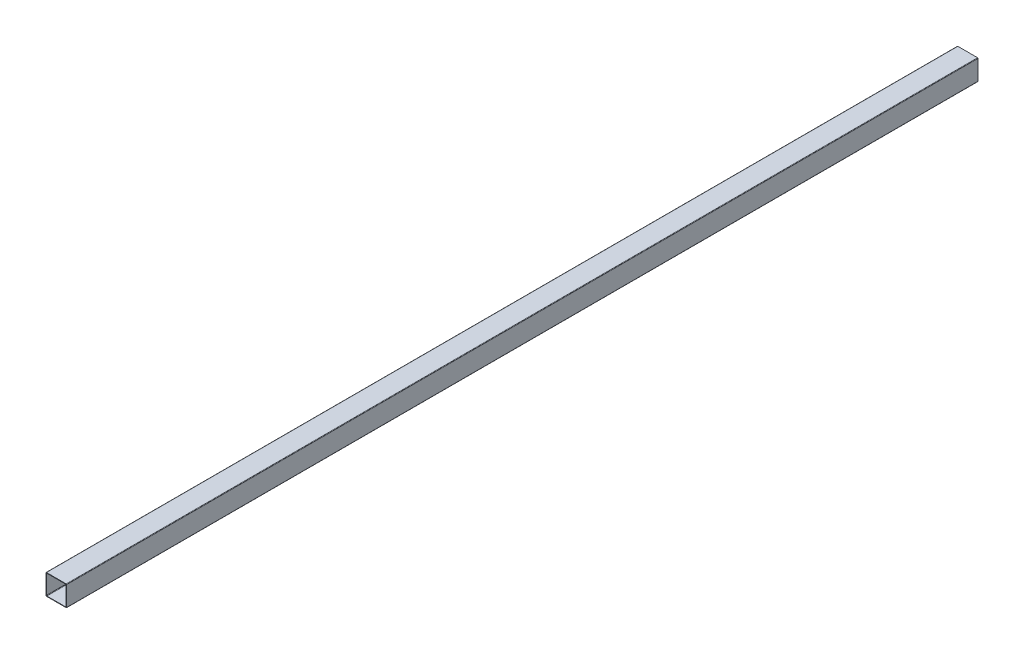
SolidWorks part; units mm, degrees
ref_plane "Plan de face" through (0, 0, 0) normal (0, 0, 1) x (1, 0, 0)
ref_plane "Plan de dessus" through (0, 0, 0) normal (0, 1, 0) x (1, 0, 0)
ref_plane "Plan de droite" through (0, 0, 0) normal (1, 0, 0) x (0, 0, -1)
sketch "Esquisse1" plane through (0, 0, 0) normal (0, 0, 1) x (1, 0, 0)
  line L1 (41, -43) -> (-41, -43)
  line L2 (43, -41) -> (43, 41)
  line L3 (41, 43) -> (-41, 43)
  line L4 (-43, -41) -> (-43, 41)
  line L5 (43, -43) -> (-43, 43) construction
  line L6 (43, 43) -> (-43, -43) construction
  line L7 (43, -45) -> (-43, -45)
  line L8 (45, -43) -> (45, 43)
  line L9 (43, 45) -> (-43, 45)
  line L10 (-45, -43) -> (-45, 43)
  line L11 (45, -45) -> (-45, 45) construction
  line L12 (45, 45) -> (-45, -45) construction
  arc A0 (-41, 43) -> (-43, 41) centre (-41, 41) ccw
  arc A1 (43, 41) -> (41, 43) centre (41, 41) ccw
  arc A2 (41, -43) -> (43, -41) centre (41, -41) ccw
  arc A3 (-41, -43) -> (-43, -41) centre (-41, -41) cw
  arc A4 (-43, -45) -> (-45, -43) centre (-43, -43) cw
  arc A5 (43, -45) -> (45, -43) centre (43, -43) ccw
  arc A6 (45, 43) -> (43, 45) centre (43, 43) ccw
  arc A7 (-43, 45) -> (-45, 43) centre (-43, 43) ccw
  point P0 (0, 0)
  point P6 (0, 0)
  dimension "D1" = 2
  dimension "D2" = 90
  dimension "D3" = 2
  dimension "D4" = 90
  dimension "D5" = 2
extrude "Boss.-Extru.1" add sketch "Esquisse1" along normal blind 3975
